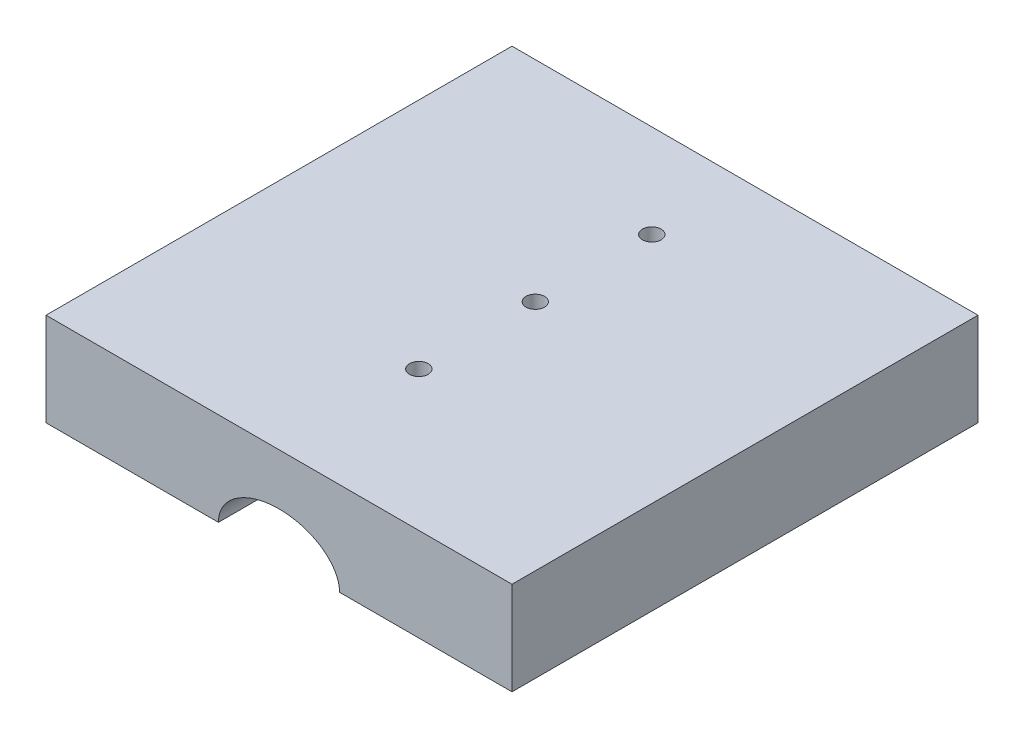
SolidWorks part; units mm, degrees
ref_plane "Front" through (0, 0, 0) normal (0, 0, 1) x (1, 0, 0)
ref_plane "Top" through (0, 0, 0) normal (0, 1, 0) x (1, 0, 0)
ref_plane "Right" through (0, 0, 0) normal (1, 0, 0) x (0, 0, -1)
sketch "草图1" plane through (0, 0, 0) normal (0, 0, 1) x (1, 0, 0)
  line L0 (-13, 0) -> (-50, 0)
  line L1 (50, 0) -> (13, 0)
  line L2 (50, 0) -> (50, 20)
  line L3 (50, 20) -> (-50, 20)
  line L4 (-50, 0) -> (-50, 20)
  line L5 (50, 0) -> (-50, 20) construction
  line L6 (50, 20) -> (-50, 0) construction
  ellipse E0 centre (0, 0) end of major axis (-13, 0) minor radius 9 (13, 0) -> (-13, 0) ccw
  point P0 (0, 10)
  dimension "宽度" = 100
  dimension "厚度" = 20
  dimension "长直径" = 26
  dimension "短直径" = 18
extrude "凸台-拉伸1" add sketch "草图1" along normal blind 100
sketch "草图2" plane through (0, 20, 0) normal (0, 1, 0) x (1, 0, 0)
  line L0 (50, 0) -> (-50, 0) construction
  circle A0 centre (0, -20) radius 2
  dimension "孔径" = 4
  dimension "端距" = 20
extrude "切除-拉伸1" cut sketch "草图2" against normal through all
pattern_linear "阵列(线性)1" count 3 spacing 25 along (0, 0, 1) of "切除-拉伸1"
